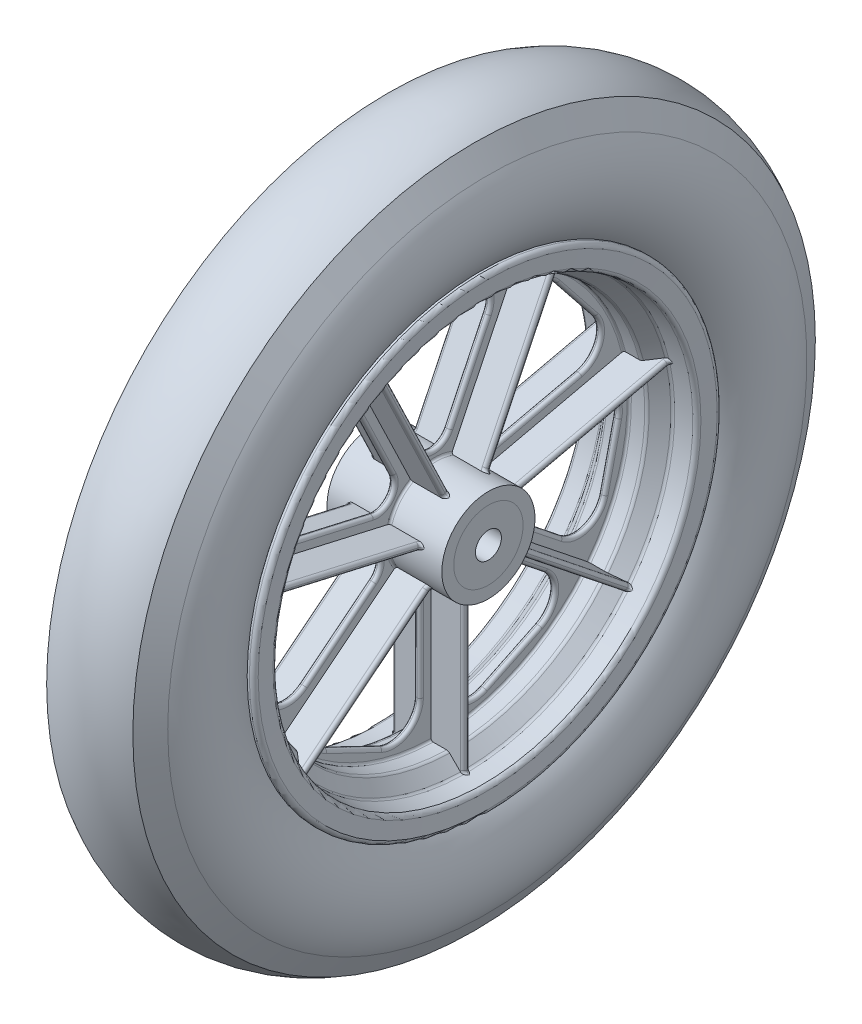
SolidWorks part; units mm, degrees
ref_plane "Plan de face" through (0, 0, 0) normal (0, 0, 1) x (1, 0, 0)
ref_plane "Plan de dessus" through (0, 0, 0) normal (0, 1, 0) x (1, 0, 0)
ref_plane "Plan de droite" through (0, 0, 0) normal (1, 0, 0) x (0, 0, -1)
sketch "Esquisse1" plane through (0, 0, 0) normal (1, 0, 0) x (0, 0, -1)
  circle A0 centre (0, 0) radius 6
  circle A1 centre (0, 0) radius 16
  dimension "D1" = 12
  dimension "D2" = 32
extrude "Boss.-Extru.1" add sketch "Esquisse1" along normal blind 46
ref_plane "Plan1" through (19.5, 0, 0) normal (1, 0, 0) x (0, 0, -1)
sketch "Esquisse2" plane through (19.5, 0, 0) normal (1, 0, 0) x (0, 0, -1)
  circle A0 centre (0, 0) radius 16 construction
  circle A1 centre (0, 0) radius 16
  circle A2 centre (0, 0) radius 21.5
  dimension "D1" = 43
extrude "Boss.-Extru.2" add sketch "Esquisse2" along normal mid plane 53
sketch "Esquisse3" plane through (0, 0, 0) normal (0, 0, 1) x (1, 0, 0)
  line L0 (-4.657, 108) -> (43.657, 108)
  line L1 (19.5, 26.1369) -> (19.5, 133.5802) construction
  line L2 (19.5, -23.65) -> (19.5, 23.65) construction
  line L3 (-6.655, 105.9092) -> (-6.3295, 98.749)
  line L4 (-4.5059, 96.8474) -> (3.1617, 96.1766)
  line L5 (4.4016, 95.5984) -> (9.4142, 90.5858)
  line L6 (10.8284, 90) -> (28.1716, 90)
  line L7 (29.5858, 90.5858) -> (34.5984, 95.5984)
  line L8 (35.8383, 96.1766) -> (43.5059, 96.8474)
  line L9 (45.3295, 98.749) -> (45.655, 105.9092)
  line L10 (-23.7591, 0) -> (72.2155, 0) construction
  arc A0 (28.1716, 90) -> (29.5858, 90.5858) centre (28.1716, 92) ccw
  arc A1 (9.4142, 90.5858) -> (10.8284, 90) centre (10.8284, 92) ccw
  arc A2 (3.1617, 96.1766) -> (4.4016, 95.5984) centre (2.9874, 94.1842) cw
  arc A3 (34.5984, 95.5984) -> (35.8383, 96.1766) centre (36.0126, 94.1842) cw
  arc A4 (43.5059, 96.8474) -> (45.3295, 98.749) centre (43.3316, 98.8398) ccw
  arc A5 (-6.3295, 98.749) -> (-4.5059, 96.8474) centre (-4.3316, 98.8398) ccw
  arc A6 (43.657, 108) -> (45.655, 105.9092) centre (43.657, 106) cw
  arc A7 (-4.657, 108) -> (-6.655, 105.9092) centre (-4.657, 106) ccw
  point P17 (29, 90)
  point P20 (10, 90)
  point P27 (45.25, 97)
  point P30 (-6.25, 97)
  point P33 (45.75, 108)
  point P36 (-6.75, 108)
  dimension "D8" = 2
  dimension "D9" = 2
  dimension "D1" = 52.5
  dimension "D2" = 216
  dimension "D3" = 51.5
  dimension "D4" = 11
  dimension "D5" = 19
  dimension "D6" = 180
  dimension "D7" = 5
revolve "Révolution1" add sketch "Esquisse3" angle 360 about L10
sketch "Esquisse4" plane through (19.5, 0, 0) normal (1, 0, 0) x (0, 0, -1)
  circle A0 centre (0, 0) radius 90 construction
  circle A1 centre (0, 0) radius 90
  circle A2 centre (0, 0) radius 21.5 construction
  circle A3 centre (0, 0) radius 21.5
extrude "Boss.-Extru.3" add sketch "Esquisse4" along normal mid plane 3
fillet "Congé1" radius 1 4 edges at (18, 0, -21.5) (18, 0, -90) (21, 0, -90) (21, 0, -21.5)
sketch "Esquisse5" plane through (18, 0, 0) normal (-1, 0, 0) x (0, 0, 1)
  line L0 (-14.1203, 84) -> (14.1203, 84)
  line L1 (24.9332, 66.7961) -> (7.2086, 29.9671)
  line L2 (-7.2086, 29.9671) -> (-24.9332, 66.7961)
  line L3 (0, 0) -> (0, 116.3818) construction
  line L4 (0, 0) -> (52.0998, 108.2554) construction
  line L5 (0, 0) -> (-54.8002, 113.8664) construction
  arc A0 (7.2086, 29.9671) -> (-7.2086, 29.9671) centre (0, 33.4364) cw
  arc A1 (14.1203, 84) -> (24.9332, 66.7961) centre (14.1203, 72) cw
  arc A2 (-14.1203, 84) -> (-24.9332, 66.7961) centre (-14.1203, 72) ccw
  point P10 (0, 14.9887)
  dimension "D4" = 8
  dimension "D5" = 12
  dimension "D1" = 25.7
  dimension "D2" = 25.7
  dimension "D3" = 13
  dimension "D6" = 84
extrude "Enlèv. mat.-Extru.1" cut sketch "Esquisse5" against normal through all
fillet "Congé2" radius 1.5 12 edges at (21, 25.4364, 0) (21, 48.3816, 16.0709) (21, 78.3857, 24.2802) (21, 84, 0) (21, 78.3857, -24.2802) (18, 78.3857, -24.2802) (18, 84, 0) (18, 78.3857, 24.2802) (18, 48.3816, 16.0709) (18, 25.4364, 0) (21, 48.3816, -16.0709) (18, 48.3816, -16.0709)
pattern_circular "Répétition circulaire1" count 7 over 360 about axis through (0, 0, 0) along (1, 0, 0) of "Enlèv. mat.-Extru.1", "Congé2"
sketch "Esquisse6" plane through (46, 0, 0) normal (1, 0, 0) x (0, 0, -1)
  circle A0 centre (0, 0) radius 16 construction
  circle A1 centre (0, 0) radius 16
ref_plane "Plan2" through (0, -50, 0) normal (0, 1, 0) x (1, 0, 0)
sketch "Esquisse7" plane through (0, -50, 0) normal (0, 1, 0) x (1, 0, 0)
  line L0 (-46.6123, 0) -> (89.3818, 0) construction
  line L1 (3, -1.5) -> (36, -1.5)
  line L2 (3, -1.5) -> (3, 1.5)
  line L3 (3, 1.5) -> (36, 1.5)
  line L4 (36, -1.5) -> (36, 1.5)
  line L5 (19.5, -23.65) -> (19.5, 23.65) construction
  line L6 (19.5, 26.2935) -> (19.5, -32.0895) construction
  dimension "D1" = 3
  dimension "D2" = 33
extrude "Boss.-Extru.4" add sketch "Esquisse7" along normal up to next and the other way up to next
fillet "Congé3" radius 1.5 4 edges at (36, -21.5, 0) (3, -21.5, 0) (36, -96.1907, 0) (3, -96.1907, 0)
fillet "Congé5" radius 1.5 12 edges at (36.33, -22.0103, 1.5) (36.5646, -21.7757, -1.5) (36, -58.8777, 1.5) (36, -58.8777, -1.5) (2.67, -22.0103, -1.5) (2.4354, -21.7757, 1.5) (3, -58.8777, -1.5) (3, -58.8777, 1.5) (2.5355, -95.8898, -1.5) (2.6712, -95.7416, 1.5) (36.4645, -95.8898, 1.5) (36.3288, -95.7416, -1.5)
pattern_circular "Répétition circulaire2" count 7 over 360 about axis through (0, 0, 0) along (1, 0, 0) of "Boss.-Extru.4", "Congé3", "Congé5"
sketch "Esquisse8" plane through (0, 0, 0) normal (0, 0, 1) x (1, 0, 0)
  line L0 (-44.3315, 0) -> (84.0278, 0) construction
  line L1 (19.5, 180.4913) -> (19.5, 76.5527) construction
  line L2 (-6.655, 105.9092) -> (-6.655, -105.9092) construction
  line L3 (45.655, 105.9092) -> (45.655, -105.9092) construction
  line L4 (43.657, 108) -> (-4.657, 108) construction
  line L5 (-6.657, 106) -> (-6.657, -106) construction
  line L6 (-6.5, 147.5) -> (-0.3853, 157.5)
  line L7 (45.5, 147.5) -> (39.3853, 157.5)
  line L8 (-3.657, 108) -> (42.657, 108)
  arc A0 (-3.657, 108) -> (-6.5, 147.5) centre (22.5476, 129.7384) cw
  arc A1 (-0.3853, 157.5) -> (39.3853, 157.5) centre (19.5, 124.3022) cw
  arc A2 (42.657, 108) -> (45.5, 147.5) centre (16.4524, 129.7384) ccw
  dimension "D6" = 326
  dimension "D1" = 3
  dimension "D2" = 62
  dimension "D3" = 295
  dimension "D4" = 52
  dimension "D5" = 315
revolve "Révolution2" add sketch "Esquisse8" angle 360 about L0
